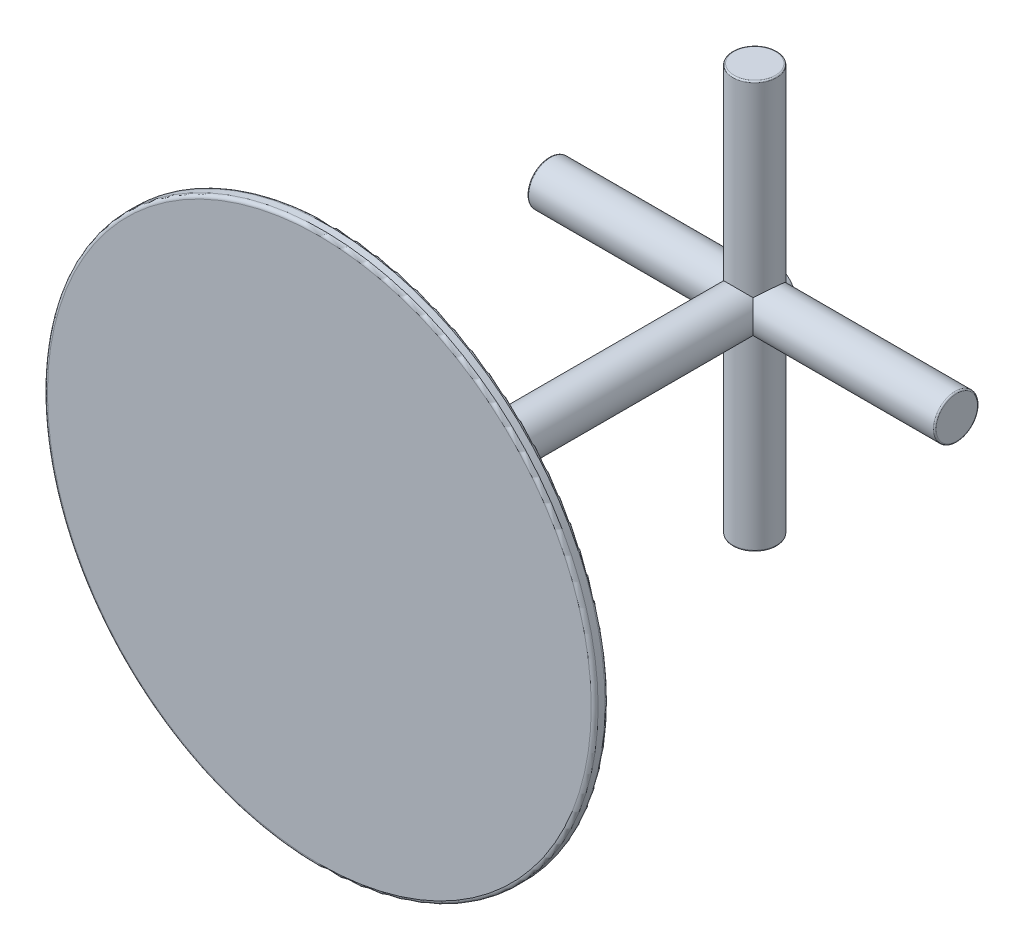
SolidWorks part; units mm, degrees
ref_plane "Plane1" through (0, 0, 0) normal (0, 0, 1) x (1, 0, 0)
ref_plane "Plane2" through (0, 0, 0) normal (0, 1, 0) x (1, 0, 0)
ref_plane "Plane3" through (0, 0, 0) normal (1, 0, 0) x (0, 0, -1)
sketch "Sketch1" plane through (0, 0, 0) normal (0, 0, 1) x (1, 0, 0)
  circle A0 centre (0, 0) radius 508
  dimension "D1" = 1016
extrude "Base-Extrude" add sketch "Sketch1" along normal blind 25.4
sketch "Sketch5" plane through (0, 0, 0) normal (0, 0, -1) x (-1, 0, 0)
  circle A0 centre (0, 0) radius 40.64
  dimension "D1" = 81.28
extrude "Boss-Extrude1" add sketch "Sketch5" along normal blind 812.8
sketch "Sketch6" plane through (0, 0, 0) normal (1, 0, 0) x (0, 0, -1)
  line L0 (-25.4, 0) -> (0, 0) construction
  circle A1 centre (774.7102, 0) radius 40.64
extrude "Boss-Extrude2" add sketch "Sketch6" along normal mid plane 751.84
sketch "Sketch7" plane through (0, 0, 0) normal (0, 1, 0) x (1, 0, 0)
  circle A0 centre (0, 777.8878) radius 40.64
  dimension "D1" = 81.28
extrude "Boss-Extrude3" add sketch "Sketch7" along normal mid plane 751.84
fillet "Fillet2" radius 6.35 2 edges at (508, 0, 0) (508, 0, 25.4)
fillet "Fillet3" radius 2.54 4 edges at (-375.92, 0, -815.3502) (375.92, 0, -815.3502) (0, -375.92, -737.2478) (0, 375.92, -737.2478)
